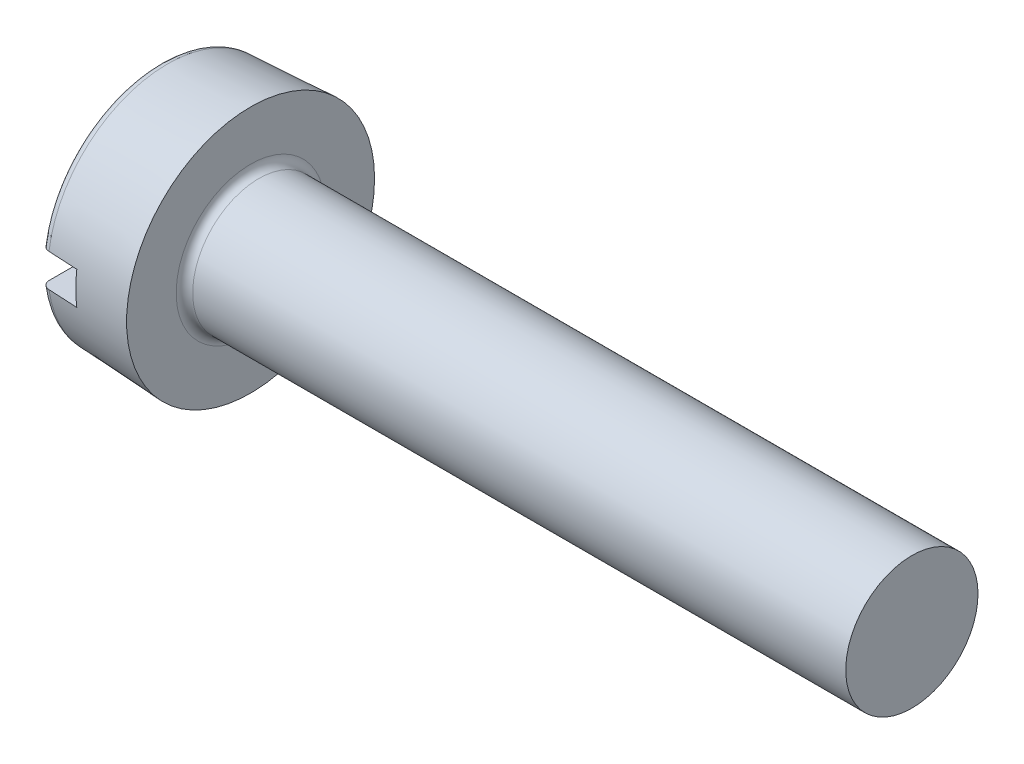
SolidWorks part; units mm, degrees
ref_plane "Front" through (0, 0, 0) normal (0, 0, 1) x (1, 0, 0)
ref_plane "Top" through (0, 0, 0) normal (0, 1, 0) x (1, 0, 0)
ref_plane "Right" through (0, 0, 0) normal (1, 0, 0) x (0, 0, -1)
ref_plane "Plane1" through (1.1, 0, 0) normal (1, 0, 0) x (0, 0, -1)
sketch "Sketch2" plane through (1.1, 0, 0) normal (1, 0, 0) x (0, 0, -1)
  circle A0 centre (0, 0) radius 1.5
  dimension "dk" = 3
extrude "BaseHead" add sketch "Sketch2" against normal blind 1.1 draft 3
sketch "Sketch3" plane through (1.1, -1.1101, -1.3544) normal (1, 0, 0) x (0, 0, -1)
  line L0 (-1.3544, 1.1101) -> (-0.6544, 1.1101) construction
  circle A0 centre (-1.3544, 1.1101) radius 0.8
  circle A1 centre (-1.3544, 1.1101) radius 1.5 construction
  dimension "d" = 1.6
  dimension "a" = 0.7
extrude "BaseBody" add sketch "Sketch3" along normal blind 8
sketch "Sketch4" plane through (-1.9, -1.9, 0) normal (0, 0, 1) x (0, 1, 0)
  line L1 (1.7, -1.9) -> (2.1, -1.9)
  line L2 (1.7, -1.9) -> (1.7, -2.35)
  line L3 (1.7, -2.35) -> (2.1, -2.35)
  line L4 (2.1, -1.9) -> (2.1, -2.35)
  line L5 (3.3424, -1.9) -> (0.4576, -1.9) construction
  dimension "n" = 0.4
  dimension "m" = 0.2
  dimension "t" = 0.45
extrude "Slot" cut sketch "Sketch4" against normal through all and the other way through all
fillet "HeadFillet" radius 0.1 3 edges at (1.1, 0, -0.8) (0, -1.4424, 0) (0, 1.4424, 0)
sketch "Sketch1" plane through (0, 0, 0) normal (0, 0, 1) x (1, 0, 0)
  line L0 (5.5483, 0) -> (-2.9147, 0) construction
  line L1 (1.1, 5.6105) -> (-15.9, 5.6105)
  line L2 (1.1, 5.6105) -> (1.1, 0.6105)
  line L3 (1.1, 0.6105) -> (-16.8, 0.6105)
  line L8 (-15.9, 0.8) -> (-16.8, 0.6105)
  line L9 (-15.9, 5.6105) -> (-15.9, 0.8)
  line L10 (1.1, -1.5) -> (1.1, 1.5) construction
  line L11 (9.1, -0.8) -> (9.1, 0.8) construction
  line L12 (9.1, 0.8) -> (1.2, 0.8) construction
  dimension "b1" = 1.221
  dimension "b" = 25
  dimension "x" = 0.9
  dimension "dd" = 5
sketch "Sketch5" plane through (0, 0, 0) normal (0, 0, 1) x (1, 0, 0)
  line L0 (9.1947, 0.8) -> (9.1947, 0.9895)
  line L1 (9.1947, 0.9895) -> (9.0052, 0.9895)
  line L2 (9.0052, 0.9895) -> (9.0052, 0.8)
  line L3 (9.0052, 0.8) -> (9.1, 0.6359)
  line L4 (9.1, 0.6359) -> (9.1947, 0.8)
  line L5 (9.1, -0.8) -> (9.1, 0.8) construction
  line L6 (0, 0) -> (15.9087, 0) construction
  dimension "D1" = 1.6
  dimension "D2" = 0.1895
revolve "Cut-Revolve10" [suppressed] cut sketch "Sketch5" angle 360 about L6
pattern_linear "LPattern10" [suppressed] count 35 spacing 0.2274 along (1, 0, 0)
equation "\"m@Sketch4\" = \"n@Sketch4\" / 2"
equation "\"D1@Plane1\"=\"k@BaseHead\""
equation "\"D1@Sketch5\" = \"d@Sketch3\""
equation "\"D2@Sketch5\" =  ( \"d@Sketch3\" - \"D2@ThreadCosmetic1\" )  / 2"
equation "\"D3@LPattern10\" = \"D2@Sketch5\" * 1.2"
equation "\"D1@LPattern10\" = \"D1@ThreadCosmetic1\" / \"D3@LPattern10\""
